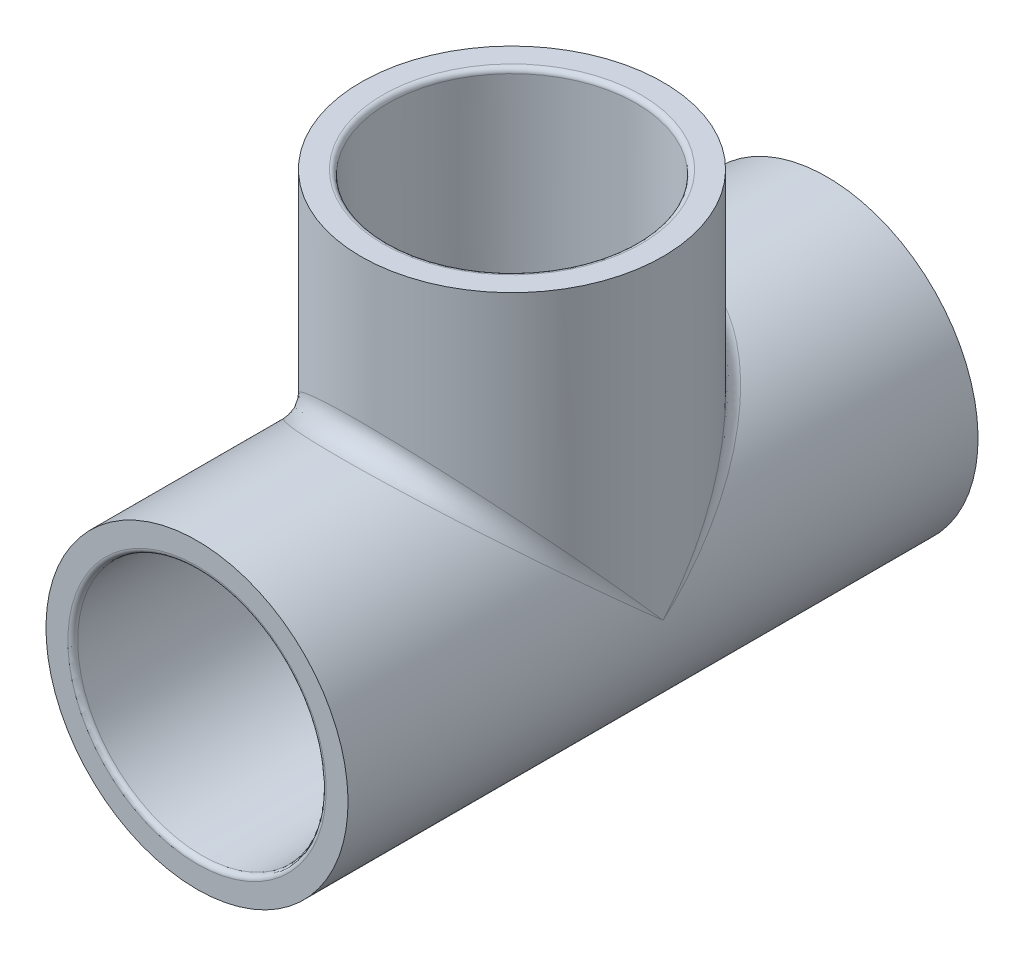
SolidWorks part; units mm, degrees
ref_plane "Front Plane" through (0, 0, 0) normal (0, 0, 1) x (1, 0, 0)
ref_plane "Top Plane" through (0, 0, 0) normal (0, 1, 0) x (1, 0, 0)
ref_plane "Right Plane" through (0, 0, 0) normal (1, 0, 0) x (0, 0, -1)
sketch "Sketch1" plane through (0, 0, 0) normal (1, 0, 0) x (0, 0, -1)
  line L0 (-42.672, 0) -> (42.672, 0) construction
  line L1 (-42.672, 0) -> (-42.672, -20.4597)
  line L2 (-42.672, -20.4597) -> (42.672, -20.4597)
  line L3 (42.672, -20.4597) -> (42.672, 0)
  line L4 (-42.672, -16.8275) -> (-18.034, -16.637)
  line L5 (-18.034, -16.637) -> (-18.034, -15.7607)
  line L6 (-18.034, -15.7607) -> (0, -15.7607)
  line L7 (0, -15.7607) -> (0, 0)
  line L8 (0, -15.7607) -> (0, -20.4597) construction
  point P2 (0, 0)
sketch "Sketch2" plane through (0, 0, 0) normal (1, 0, 0) x (0, 0, -1)
  line L0 (0, 0) -> (0, 42.672) construction
  line L1 (0, 42.672) -> (20.4597, 42.672)
  line L2 (20.4597, 42.672) -> (20.4597, 0)
  line L3 (-42.672, 0) -> (42.672, 0) construction
  line L4 (20.4597, 0) -> (0, 0)
  line L5 (16.8275, 42.672) -> (16.637, 18.034)
  line L6 (16.637, 18.034) -> (14.5415, 18.034)
  line L7 (14.5415, 18.034) -> (14.5415, 0)
  line L8 (-18.034, -15.7607) -> (0, -15.7607) construction
sketch "Sketch3" plane through (0, 0, 0) normal (1, 0, 0) x (0, 0, -1)
  line L1 (-42.672, 0) -> (42.672, 0)
  line L2 (-42.672, 0) -> (-42.672, -20.4597)
  line L3 (-42.672, -20.4597) -> (42.672, -20.4597)
  line L4 (42.672, 0) -> (42.672, -20.4597)
revolve "Revolve1" add sketch "Sketch3" angle 360 about L1
sketch "Sketch4" plane through (0, 0, 0) normal (1, 0, 0) x (0, 0, -1)
  line L1 (0, 42.672) -> (20.4597, 42.672)
  line L2 (0, 42.672) -> (0, 0)
  line L3 (0, 0) -> (20.4597, 0)
  line L4 (20.4597, 42.672) -> (20.4597, 0)
revolve "Revolve2" add sketch "Sketch4" angle 360 about L2
sketch "Sketch5" plane through (0, 0, 0) normal (1, 0, 0) x (0, 0, -1)
  line L0 (-18.034, -15.7607) -> (0, -15.7607) construction
  line L1 (-18.034, -16.637) -> (-18.034, -15.7607) construction
  line L2 (-42.672, -16.8275) -> (-18.034, -16.637) construction
  line L3 (-18.034, -15.7607) -> (18.034, -15.7607)
  line L4 (-18.034, -16.637) -> (-18.034, -15.7607)
  line L5 (-42.672, -16.8275) -> (-18.034, -16.637)
  line L6 (-42.672, -16.8275) -> (-42.672, 0)
  line L7 (-42.672, 0) -> (42.672, 0)
  line L8 (0, 0) -> (0, -15.7607) construction
  line L9 (18.034, -16.637) -> (18.034, -15.7607)
  line L10 (42.672, -16.8275) -> (18.034, -16.637)
  line L11 (42.672, -16.8275) -> (42.672, 0)
revolve "Cut-Revolve1" cut sketch "Sketch5" angle 360 about L7
sketch "Sketch6" plane through (0, 0, 0) normal (1, 0, 0) x (0, 0, -1)
  line L0 (14.5415, 0) -> (14.5415, 18.034)
  line L1 (14.5415, 18.034) -> (16.637, 18.034)
  line L2 (16.8275, 42.672) -> (16.637, 18.034) construction
  line L3 (16.8275, 42.672) -> (16.637, 18.034)
  line L4 (0, 0) -> (0, 42.672) construction
  line L5 (0, 0) -> (0, 42.672)
  line L6 (0, 42.672) -> (16.8275, 42.672)
  line L7 (0, 0) -> (14.5415, 0)
revolve "Cut-Revolve2" cut sketch "Sketch6" angle 360 about L5
fillet "Fillet1" radius 0.5239 3 edges at (0, -16.637, -18.034) (0, 18.034, -16.637) (0, -16.637, 18.034)
fillet "Fillet2" radius 0.6731 3 edges at (0, -16.8275, -42.672) (0, 42.672, -16.8275) (0, -16.8275, 42.672)
fillet "Fillet3" radius 2.7965 2 edges at (0, 20.4597, 20.4597) (0, 20.4597, -20.4597)
sketch "Sketch7" plane through (0, 0, 0) normal (1, 0, 0) x (0, 0, -1)
  line L0 (-18.034, -15.7607) -> (0, -15.7607) construction
  line L1 (-18.034, -16.637) -> (-18.034, -15.7607) construction
  line L2 (-42.672, -16.8275) -> (-18.034, -16.637) construction
  line L3 (-18.034, -15.7607) -> (18.034, -15.7607)
  line L4 (-18.034, -16.637) -> (-18.034, -15.7607)
  line L5 (-42.672, -16.8275) -> (-18.034, -16.637)
  line L6 (0, 0) -> (0, -15.7607) construction
  line L7 (0, 0) -> (-42.672, 0) construction
  line L8 (-18.034, 15.7607) -> (-14.5415, 15.7607)
  line L9 (-18.034, 16.637) -> (-18.034, 15.7607)
  line L10 (-42.672, 16.8275) -> (-18.034, 16.637)
  line L11 (16.8275, 42.672) -> (16.637, 18.034) construction
  line L12 (16.637, 18.034) -> (14.5415, 18.034) construction
  line L13 (14.5415, 18.034) -> (14.5415, 0) construction
  line L14 (16.8275, 42.672) -> (16.637, 18.034)
  line L15 (16.637, 18.034) -> (14.5415, 18.034)
  line L16 (14.5415, 18.034) -> (14.5415, 15.7607)
  line L17 (-14.5415, 18.034) -> (-14.5415, 15.7607)
  line L18 (-16.637, 18.034) -> (-14.5415, 18.034)
  line L19 (-16.8275, 42.672) -> (-16.637, 18.034)
  line L20 (18.034, -16.637) -> (18.034, -15.7607)
  line L21 (42.672, -16.8275) -> (18.034, -16.637)
  line L22 (18.034, 16.637) -> (18.034, 15.7607)
  line L23 (42.672, 16.8275) -> (18.034, 16.637)
  line L24 (14.5415, 15.7607) -> (18.034, 15.7607)
  point P24 (0, 15.7607)
  point P29 (-42.672, -16.8275)
equation "\"D1@Sketch2\"=\"Diameter 1@Sketch1\""
equation "\"D2@Sketch2\"=\"Diameter 2@Sketch1\""
equation "\"D3@Sketch2\"=\"Socket Depth@Sketch1\""
equation "\"D1@Fillet1\"=0.25*(\"Diameter 2@Sketch1\"-\"Diameter 3@Sketch2\")*0.5"
equation "\"D1@Fillet2\"=.02*\"Diameter 1@Sketch1\""
equation "\"D1@Fillet3\"=.075*(\"Diameter 1@Sketch1\"+\"Wall 1@Sketch1\")"
